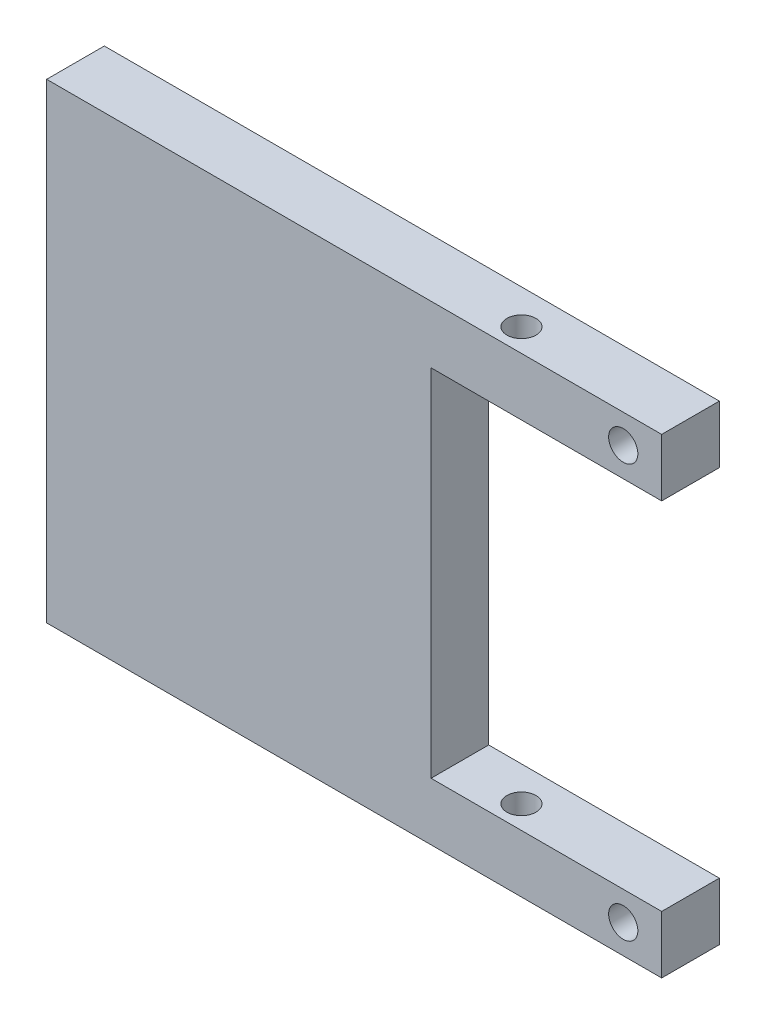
SolidWorks part; units mm, degrees
ref_plane "Plane1" through (0, 0, 0) normal (0, 0, 1) x (1, 0, 0)
ref_plane "Plane2" through (0, 0, 0) normal (0, 1, 0) x (1, 0, 0)
ref_plane "Plane3" through (0, 0, 0) normal (1, 0, 0) x (0, 0, -1)
sketch "Sketch1" plane through (0, 0, 0) normal (0, 0, 1) x (1, 0, 0)
  line L0 (0, 0) -> (0, 77.7748)
  line L1 (0, 77.7748) -> (101.6, 77.7748)
  line L2 (101.6, 77.7748) -> (101.6, 68.2498)
  line L3 (101.6, 68.2498) -> (63.5, 68.2498)
  line L4 (63.5, 68.2498) -> (63.5, 9.525)
  line L5 (63.5, 9.525) -> (101.6, 9.525)
  line L6 (101.6, 9.525) -> (101.6, 0)
  line L7 (101.6, 0) -> (0, 0)
  dimension "D1" = 77.7748
  dimension "D2" = 101.6
  dimension "D3" = 38.1
  dimension "D4" = 101.6
  dimension "D5" = 9.525
  dimension "D6" = 9.525
extrude "Base-Extrude" add sketch "Sketch1" along normal blind 9.525
sketch "Sketch2" plane through (0, 77.7748, 0) normal (0, 1, 0) x (-1, 0, 0)
  circle A0 centre (-74.6252, 5.715) radius 2.4003
  dimension "D1" = 4.8006
  dimension "D2" = 26.9748
  dimension "D3" = 5.715
extrude "Cut-Extrude1" cut sketch "Sketch2" against normal through all
sketch "Sketch3" plane through (0, 0, 0) normal (0, 0, -1) x (-1, 0, 0)
  line L2 (-101.6, 9.525) -> (-101.6, 0) construction
  circle A0 centre (-95.25, 4.7752) radius 2.413
  dimension "D1" = 4.826
  dimension "D2" = 4.7498
  dimension "D3" = 6.35
extrude "Cut-Extrude2" cut sketch "Sketch3" against normal through all
sketch "Sketch5" plane through (0, 0, 9.525) normal (0, 0, 1) x (1, 0, 0)
  line L0 (101.6, 77.7748) -> (101.6, 68.2498) construction
  line L1 (0, 77.7748) -> (101.6, 77.7748) construction
  circle A0 centre (95.25, 73.025) radius 2.413
  dimension "D1" = 4.826
  dimension "D2" = 6.35
  dimension "D3" = 4.7498
extrude "Cut-Extrude3" cut sketch "Sketch5" against normal through all
